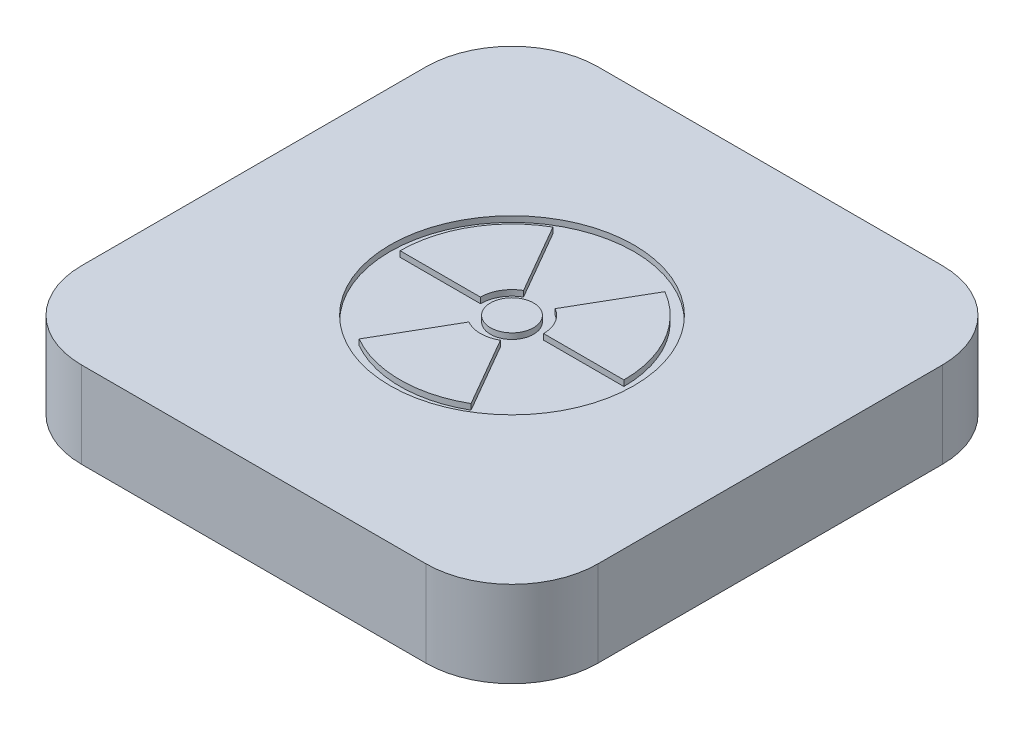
SolidWorks part; units mm, degrees
other "<壳子>-<切除-拉伸30>"
ref_plane "前视基准面" through (0, 0, 0) normal (0, 0, 1) x (1, 0, 0)
ref_plane "上视基准面" through (0, 0, 0) normal (0, 1, 0) x (1, 0, 0)
ref_plane "右视基准面" through (0, 0, 0) normal (1, 0, 0) x (0, 0, -1)
inserted part "壳子"
sketch "草图2" plane through (0, 145, 0) normal (0, 1, 0) x (1, 0, 0)
  line L4 (-60, -90) -> (60, -90)
  line L5 (90, -60) -> (90, 60)
  line L6 (60, 90) -> (-60, 90)
  line L7 (-90, 60) -> (-90, -60)
  line L8 (-60, -90) -> (60, -90)
  line L9 (90, -60) -> (90, 60)
  line L10 (60, 90) -> (-60, 90)
  line L11 (-90, 60) -> (-90, -60)
  arc A4 (60, -90) -> (90, -60) centre (60, -60) ccw
  arc A5 (90, 60) -> (60, 90) centre (60, 60) ccw
  arc A6 (-60, 90) -> (-90, 60) centre (-60, 60) ccw
  arc A7 (-90, -60) -> (-60, -90) centre (-60, -60) ccw
  arc A8 (60, -90) -> (90, -60) centre (60, -60) ccw
  arc A9 (90, 60) -> (60, 90) centre (60, 60) ccw
  arc A10 (-60, 90) -> (-90, 60) centre (-60, 60) ccw
  arc A11 (-90, -60) -> (-60, -90) centre (-60, -60) ccw
  dimension "D1" = 0
extrude "凸台-拉伸1" add sketch "草图2" along normal blind 30
sketch "草图3" plane through (0, 145, 0) normal (0, -1, 0) x (1, 0, 0)
  line L0 (30, 83.5) -> (-30, 83.5) construction
  line L1 (-30, 68.5) -> (-30, 83.5) construction
  line L2 (30, 68.5) -> (-30, 68.5) construction
  line L3 (30, 83.5) -> (30, 68.5) construction
  line L4 (-6.5, -82.5) -> (-6.5, -60) construction
  line L5 (-6.5, -60) -> (6.5, -60) construction
  line L6 (6.5, -60) -> (6.5, -82.5) construction
  line L7 (-6.5, -82.5) -> (6.5, -82.5) construction
  line L8 (-6.5, -82.5) -> (6.5, -82.5)
  line L9 (6.5, -60) -> (6.5, -82.5)
  line L10 (-6.5, -60) -> (6.5, -60)
  line L11 (-6.5, -82.5) -> (-6.5, -60)
  line L12 (30, 83.5) -> (30, 68.5)
  line L13 (30, 68.5) -> (-30, 68.5)
  line L14 (-30, 68.5) -> (-30, 83.5)
  line L15 (30, 83.5) -> (-30, 83.5)
  line L16 (27.5, 67) -> (4.5, 67)
  line L17 (-27.5, 67) -> (-27.5, 85.5)
  line L18 (-27.5, 85.5) -> (-32.5, 85.5)
  line L19 (-32.5, 85.5) -> (-32.5, 85)
  line L20 (-32.5, 85) -> (-60, 85)
  line L21 (-85, 60) -> (-85, -60)
  line L22 (-60, -85) -> (-6, -85)
  line L23 (-6, -85) -> (-6, -87)
  line L24 (-6, -87) -> (6, -87)
  line L25 (6, -87) -> (6, -85)
  line L26 (6, -85) -> (60, -85)
  line L27 (85, -60) -> (85, 60)
  line L28 (60, 85) -> (32.5, 85)
  line L29 (32.5, 85) -> (32.5, 85.5)
  line L30 (32.5, 85.5) -> (27.5, 85.5)
  line L31 (27.5, 85.5) -> (27.5, 67)
  line L32 (27.5, 67) -> (4.5, 67)
  line L33 (-27.5, 67) -> (-27.5, 85.5)
  line L34 (-27.5, 85.5) -> (-32.5, 85.5)
  line L35 (-32.5, 85.5) -> (-32.5, 85)
  line L36 (-32.5, 85) -> (-60, 85)
  line L37 (-85, 60) -> (-85, -60)
  line L38 (-60, -85) -> (-6, -85)
  line L39 (-6, -85) -> (-6, -87)
  line L40 (-6, -87) -> (6, -87)
  line L41 (6, -87) -> (6, -85)
  line L42 (6, -85) -> (60, -85)
  line L43 (85, -60) -> (85, 60)
  line L44 (60, 85) -> (32.5, 85)
  line L45 (32.5, 85) -> (32.5, 85.5)
  line L46 (32.5, 85.5) -> (27.5, 85.5)
  line L47 (27.5, 85.5) -> (27.5, 67)
  line L76 (4.5, 67) -> (4.5, 68.5)
  line L77 (4.5, 67) -> (4.5, 68.5)
  line L78 (4.5, 68.5) -> (26.4645, 68.5)
  line L79 (4.5, 68.5) -> (26.4645, 68.5)
  line L80 (26.4645, 68.5) -> (26.4645, 83.5)
  line L81 (26.4645, 68.5) -> (26.4645, 83.5)
  line L82 (26.4645, 83.5) -> (4.5, 83.5)
  line L83 (26.4645, 83.5) -> (4.5, 83.5)
  line L84 (4.5, 83.5) -> (4.5, 88)
  line L85 (4.5, 83.5) -> (4.5, 88)
  line L86 (4.5, 88) -> (-4.5, 88)
  line L87 (4.5, 88) -> (-4.5, 88)
  line L88 (-4.5, 88) -> (-4.5, 83.5)
  line L89 (-4.5, 88) -> (-4.5, 83.5)
  line L90 (-4.5, 83.5) -> (-26.4645, 83.5)
  line L91 (-4.5, 83.5) -> (-26.4645, 83.5)
  line L92 (-26.4645, 83.5) -> (-26.4645, 68.5)
  line L93 (-26.4645, 83.5) -> (-26.4645, 68.5)
  line L94 (-26.4645, 68.5) -> (-4.5, 68.5)
  line L95 (-26.4645, 68.5) -> (-4.5, 68.5)
  line L96 (-4.5, 68.5) -> (-4.5, 67)
  line L97 (-4.5, 68.5) -> (-4.5, 67)
  line L98 (-4.5, 67) -> (-27.5, 67)
  line L99 (-4.5, 67) -> (-27.5, 67)
  arc A4 (-60, 85) -> (-85, 60) centre (-60, 60) ccw
  arc A5 (-85, -60) -> (-60, -85) centre (-60, -60) ccw
  arc A6 (60, -85) -> (85, -60) centre (60, -60) ccw
  arc A7 (85, 60) -> (60, 85) centre (60, 60) ccw
  arc A8 (-60, 85) -> (-85, 60) centre (-60, 60) ccw
  arc A9 (-85, -60) -> (-60, -85) centre (-60, -60) ccw
  arc A10 (60, -85) -> (85, -60) centre (60, -60) ccw
  arc A11 (85, 60) -> (60, 85) centre (60, 60) ccw
  dimension "D1" = 0
sketch "草图4" plane through (0, 145, 0) normal (0, -1, 0) x (1, 0, 0)
  line L1 (-197.9868, 175.3905) -> (197.9868, 175.3905)
  line L2 (-197.9868, 175.3905) -> (-197.9868, -175.3905)
  line L3 (-197.9868, -175.3905) -> (197.9868, -175.3905)
  line L4 (197.9868, 175.3905) -> (197.9868, -175.3905)
  line L5 (-197.9868, 175.3905) -> (197.9868, -175.3905) construction
  line L6 (-197.9868, -175.3905) -> (197.9868, 175.3905) construction
  point P0 (0, 0)
extrude "切除-拉伸1" cut sketch "草图4" along normal blind 205
shell "抽壳1" thickness 5
sketch "草图5" plane through (0, 170, 0) normal (0, -1, 0) x (1, 0, 0)
  line L1 (-19, 86) -> (19, 86)
  line L2 (-19, 86) -> (-19, 66)
  line L3 (-19, 66) -> (19, 66)
  line L4 (19, 86) -> (19, 66)
  line L5 (-19, 86) -> (19, 66) construction
  line L6 (-19, 66) -> (19, 86) construction
  line L7 (-30, 83.5) -> (30, 68.5) construction
  line L8 (-30, 68.5) -> (30, 83.5) construction
  point P0 (0, 76)
  point P16 (0, 76)
  dimension "D1" = 38
  dimension "D2" = 20
extrude "凸台-拉伸2" add sketch "草图5" along normal blind 19
sketch "草图6" plane through (0, 145, 0) normal (0, -1, 0) x (1, 0, 0)
  line L0 (-19, 85) -> (19, 85)
  line L1 (-19, 85) -> (-19, 87)
  line L2 (19, 85) -> (19, 87)
  line L3 (-19, 87) -> (19, 87)
  dimension "D1" = 2
extrude "切除-拉伸2" cut sketch "草图6" against normal up to surface (6 mm away)
sketch "草图7" plane through (0, 145, 0) normal (0, -1, 0) x (1, 0, 0)
  line L0 (-6, -87) -> (6, -87)
  line L1 (-6, -87) -> (-6, -85)
  line L2 (6, -87) -> (6, -85)
  line L3 (-6, -85) -> (6, -85)
  line L4 (6, -85) -> (60, -85) construction
extrude "切除-拉伸3" cut sketch "草图7" against normal up to surface (25 mm away)
sketch "草图8" plane through (0, 0, -90) normal (0, 0, -1) x (-1, 0, 0)
  line L0 (-1052.5236, 154) -> (48947.4764, 154) construction
  line L1 (0, -825) -> (0, 49175) construction
  line L2 (-60, 175) -> (60, 175) construction
  line L3 (-6, 145) -> (-60, 145) construction
  line L4 (-12.5, 154) -> (12.5, 154) construction
  circle A0 centre (-12.5, 154) radius 1
  circle A1 centre (12.5, 154) radius 1
  point P4 (0, 154)
  point P5 (0, 0)
  point P15 (0, 175)
  dimension "D1" = 2
  dimension "D2" = 25
  dimension "D3" = 9
extrude "切除-拉伸4" cut sketch "草图8" against normal up to next
sketch "草图9" plane through (0, 151, 0) normal (0, -1, 0) x (1, 0, 0)
  line L0 (-30, 83.5) -> (30, 68.5) construction
  line L1 (30, 68.5) -> (30, 83.5) construction
  line L2 (30, 83.5) -> (-30, 68.5) construction
  line L3 (-30, 68.5) -> (-30, 76) construction
  line L4 (-30, 68.5) -> (-30, 83.5) construction
  line L5 (-30, 76) -> (30, 76) construction
  circle A0 centre (-12.5, 76) radius 1
  circle A1 centre (12.5, 76) radius 1
  point P16 (0, 76)
  dimension "D1" = 2
  dimension "D2" = 25
  dimension "D3" = 12.5
extrude "切除-拉伸5" cut sketch "草图9" against normal blind 8
sketch "草图10" plane through (0, 170, 0) normal (0, -1, 0) x (1, 0, 0)
  line L1 (-23.5, 11) -> (23.5, 11)
  line L2 (-23.5, 11) -> (-23.5, -11)
  line L3 (-23.5, -11) -> (-6, -11)
  line L4 (23.5, 11) -> (23.5, -11)
  line L5 (-23.5, 11) -> (23.5, -11) construction
  line L6 (-23.5, -11) -> (23.5, 11) construction
  line L7 (-6, -11) -> (-6, -4)
  line L8 (6, -11) -> (6, -4)
  line L9 (-6, -4) -> (6, -4)
  line L10 (6, -11) -> (23.5, -11)
  point P0 (0, 0)
  point P6 (0, -11)
  dimension "D1" = 47
  dimension "D2" = 22
  dimension "D3" = 7
  dimension "D4" = 12
extrude "凸台-拉伸3" add sketch "草图10" along normal blind 10
sketch "草图11" plane through (0, 170, 0) normal (0, -1, 0) x (1, 0, 0)
  line L0 (-6, -4) -> (6, -4)
  line L1 (-6, -4) -> (-6, -87)
  line L2 (6, -4) -> (6, -87)
  line L3 (-6, -87) -> (6, -87)
  line L4 (-6, -87) -> (6, -87) construction
extrude "切除-拉伸6" cut sketch "草图11" against normal blind 2
sketch "草图12" plane through (0, 160, 0) normal (0, -1, 0) x (1, 0, 0)
  line L1 (-20, 7.25) -> (20, 7.25) construction
  line L2 (-20, 7.25) -> (-20, -7.25) construction
  line L3 (-20, -7.25) -> (20, -7.25) construction
  line L4 (20, 7.25) -> (20, -7.25) construction
  line L5 (-20, 7.25) -> (20, -7.25) construction
  line L6 (-20, -7.25) -> (20, 7.25) construction
  circle A0 centre (-20, 7.25) radius 1
  circle A1 centre (20, 7.25) radius 1
  circle A2 centre (20, -7.25) radius 1
  circle A3 centre (-20, -7.25) radius 1
  point P0 (0, 0)
  dimension "D3" = 2
  dimension "D1" = 40
  dimension "D2" = 14.5
extrude "切除-拉伸7" cut sketch "草图12" against normal blind 8
sketch "草图13" plane through (0, 175, 0) normal (0, 1, 0) x (1, 0, 0)
  line L0 (19.5, 33.775) -> (5.5, 9.5263)
  line L1 (-19.5, 33.775) -> (-5.5, 9.5263)
  line L2 (-39, 0) -> (-11, 0)
  line L3 (0, -1000) -> (0, 49000) construction
  line L4 (11, 0) -> (39, 0)
  line L5 (5.5, -9.5263) -> (19.5, -33.775)
  line L6 (-5.5, -9.5263) -> (-19.5, -33.775)
  circle A0 centre (0, 0) radius 42.5
  circle A1 centre (0, 0) radius 7.5
  arc A2 (-5.5, -9.5263) -> (5.5, -9.5263) centre (0, 0) ccw
  arc A3 (-19.5, -33.775) -> (19.5, -33.775) centre (0, 0) ccw
  arc A4 (39, 0) -> (19.5, 33.775) centre (0, 0) ccw
  arc A5 (-19.5, 33.775) -> (-39, 0) centre (0, 0) ccw
  arc A6 (11, 0) -> (5.5, 9.5263) centre (0, 0) ccw
  arc A7 (-5.5, 9.5263) -> (-11, 0) centre (0, 0) ccw
  dimension "D1" = 85
  dimension "D2" = 15
  dimension "D3" = 22
  dimension "D4" = 78
  dimension "D5" = 60
  dimension "D6" = 60
  dimension "D7" = 30
extrude "切除-拉伸8" cut sketch "草图13" against normal blind 2
sketch "草图14" plane through (0, 170, 0) normal (0, -1, 0) x (1, 0, 0)
  line L0 (0, -1000) -> (0, 49000) construction
  line L1 (0, -49.8085) -> (7, -49.8085)
  line L3 (0, -52.8085) -> (7, -52.8085)
  line L4 (7, -49.8085) -> (7, -52.8085)
  line L5 (0, -51.3085) -> (7, -52.8085) construction
  line L6 (0, -51.3085) -> (7, -49.8085) construction
  line L7 (0, -49.8085) -> (0, -52.8085)
  point P0 (0, -51.3085)
  dimension "D2" = 3
extrude "凸台-拉伸4" add sketch "草图14" along normal blind 1.5
sketch "草图15" plane through (0, 0, -85) normal (0, 0, 1) x (1, 0, 0)
  line L0 (0, -1000) -> (0, 49000) construction
  line L1 (-7, 158.7107) -> (0, 158.7107)
  line L2 (-7, 158.7107) -> (-7, 155.7107)
  line L3 (-7, 155.7107) -> (0, 155.7107)
  line L5 (-7, 158.7107) -> (0, 157.2107) construction
  line L6 (-7, 155.7107) -> (0, 157.2107) construction
  line L7 (0, 158.7107) -> (0, 155.7107)
  point P0 (0, 157.2107)
extrude "凸台-拉伸5" add sketch "草图15" along normal blind 1.5
